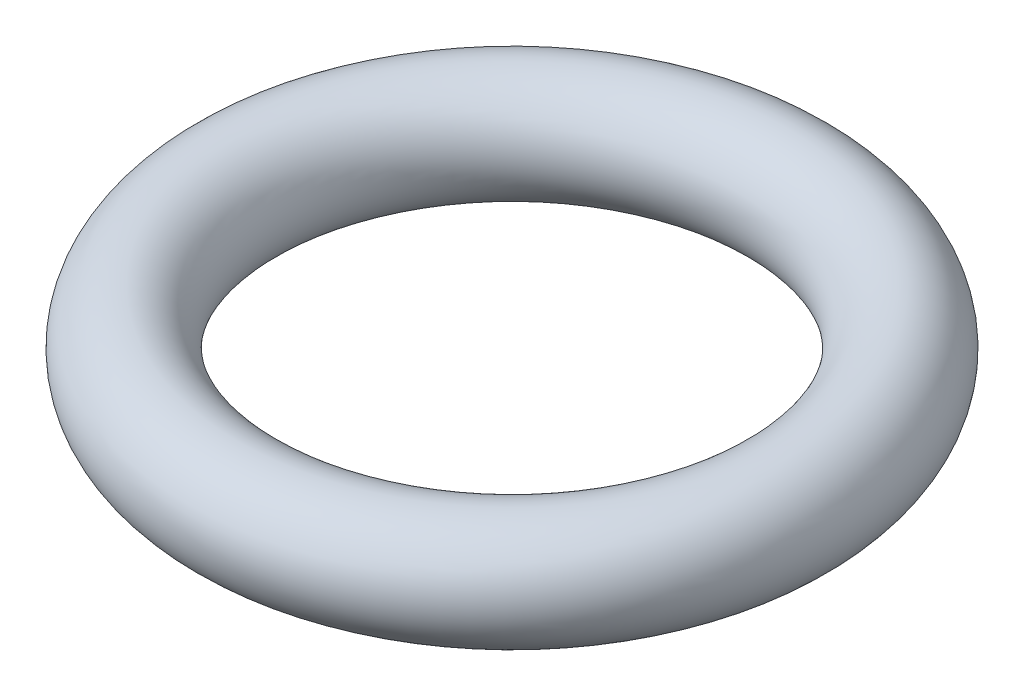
SolidWorks part; units mm, degrees
ref_plane "Front Plane" through (0, 0, 0) normal (0, 0, 1) x (1, 0, 0)
ref_plane "Top Plane" through (0, 0, 0) normal (0, 1, 0) x (1, 0, 0)
ref_plane "Right Plane" through (0, 0, 0) normal (1, 0, 0) x (0, 0, -1)
sketch "Sketch1" plane through (0, 0, 0) normal (0, 0, 1) x (1, 0, 0)
  line L0 (0, 0) -> (0, 50000) construction
  circle A0 centre (1.9844, 0) radius 0.3969
  dimension "D1" = 1.9844
revolve "Revolve1" add sketch "Sketch1" angle 360 about L0
sketch "Sketch2" plane through (0, 0, 0) normal (0, 1, 0) x (1, 0, 0)
  circle A0 centre (0, 0) radius 2.3812
